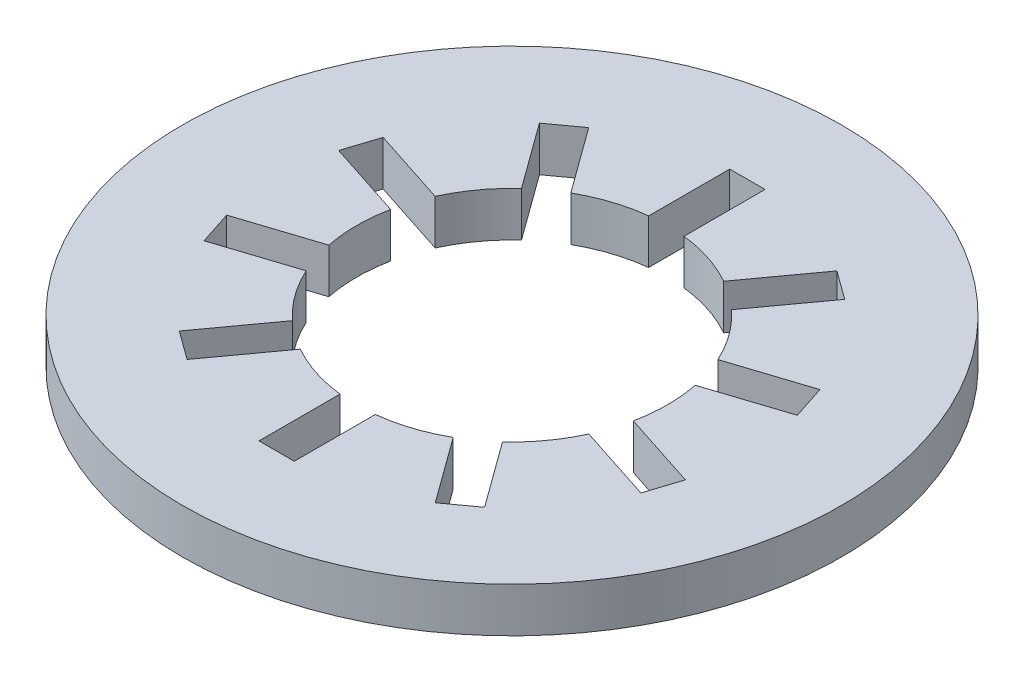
SolidWorks part; units mm, degrees
ref_plane "Спереди" through (0, 0, 0) normal (0, 0, 1) x (1, 0, 0)
ref_plane "Сверху" through (0, 0, 0) normal (0, 1, 0) x (1, 0, 0)
ref_plane "Справа" through (0, 0, 0) normal (1, 0, 0) x (0, 0, -1)
sketch "Эскиз1" plane through (0, 0, 0) normal (0, 1, 0) x (1, 0, 0)
  line L0 (0, 0) -> (0, 2.72) construction
  line L1 (1.6471, 1.9429) -> (1.1331, 1.2355)
  line L2 (0.1905, 2.54) -> (-0.1905, 2.54)
  line L3 (0.1905, 2.54) -> (0.1905, 1.6655)
  line L4 (1.6471, 1.9429) -> (1.3389, 2.1669)
  line L5 (-0.1905, 2.54) -> (-0.1905, 1.6655)
  line L6 (1.3389, 2.1669) -> (0.8249, 1.4594)
  line L7 (2.4746, 0.6037) -> (1.6429, 0.3335)
  line L8 (2.4746, 0.6037) -> (2.3568, 0.9661)
  line L9 (2.3568, 0.9661) -> (1.5252, 0.6959)
  line L10 (2.3568, -0.9661) -> (1.5252, -0.6959)
  line L11 (2.3568, -0.9661) -> (2.4746, -0.6037)
  line L12 (2.4746, -0.6037) -> (1.6429, -0.3335)
  line L13 (1.3389, -2.1669) -> (0.8249, -1.4594)
  line L14 (1.3389, -2.1669) -> (1.6471, -1.9429)
  line L15 (1.6471, -1.9429) -> (1.1331, -1.2355)
  line L16 (-0.1905, -2.54) -> (-0.1905, -1.6655)
  line L17 (-0.1905, -2.54) -> (0.1905, -2.54)
  line L18 (0.1905, -2.54) -> (0.1905, -1.6655)
  line L19 (-1.6471, -1.9429) -> (-1.1331, -1.2355)
  line L20 (-1.6471, -1.9429) -> (-1.3389, -2.1669)
  line L21 (-1.3389, -2.1669) -> (-0.8249, -1.4594)
  line L22 (-2.4746, -0.6037) -> (-1.6429, -0.3335)
  line L23 (-2.4746, -0.6037) -> (-2.3568, -0.9661)
  line L24 (-2.3568, -0.9661) -> (-1.5252, -0.6959)
  line L25 (-2.3568, 0.9661) -> (-1.5252, 0.6959)
  line L26 (-2.3568, 0.9661) -> (-2.4746, 0.6037)
  line L27 (-2.4746, 0.6037) -> (-1.6429, 0.3335)
  line L28 (-1.3389, 2.1669) -> (-0.8249, 1.4594)
  line L29 (-1.3389, 2.1669) -> (-1.6471, 1.9429)
  line L30 (-1.6471, 1.9429) -> (-1.1331, 1.2355)
  circle A0 centre (0, 0) radius 3.556
  arc A1 (-0.1905, 1.6655) -> (-0.8249, 1.4594) centre (0, 0) ccw
  arc A2 (-1.1331, 1.2355) -> (-1.5252, 0.6959) centre (0, 0) ccw
  arc A3 (-1.6429, 0.3335) -> (-1.6429, -0.3335) centre (0, 0) ccw
  arc A4 (-1.5252, -0.6959) -> (-1.1331, -1.2355) centre (0, 0) ccw
  arc A5 (-0.8249, -1.4594) -> (-0.1905, -1.6655) centre (0, 0) ccw
  arc A6 (0.1905, -1.6655) -> (0.8249, -1.4594) centre (0, 0) ccw
  arc A7 (1.1331, -1.2355) -> (1.5252, -0.6959) centre (0, 0) ccw
  arc A8 (1.6429, -0.3335) -> (1.6429, 0.3335) centre (0, 0) ccw
  arc A9 (1.5252, 0.6959) -> (1.1331, 1.2355) centre (0, 0) ccw
  arc A10 (0.8249, 1.4594) -> (0.1905, 1.6655) centre (0, 0) ccw
  point P47 (0, 0)
  dimension "D1" = 3.3528
  dimension "D2" = 7.112
  dimension "D3" = 2.54
  dimension "D4" = 0.381
  dimension "D5" = 10
extrude "Бобышка-Вытянуть1" add sketch "Эскиз1" along normal blind 0.4826
